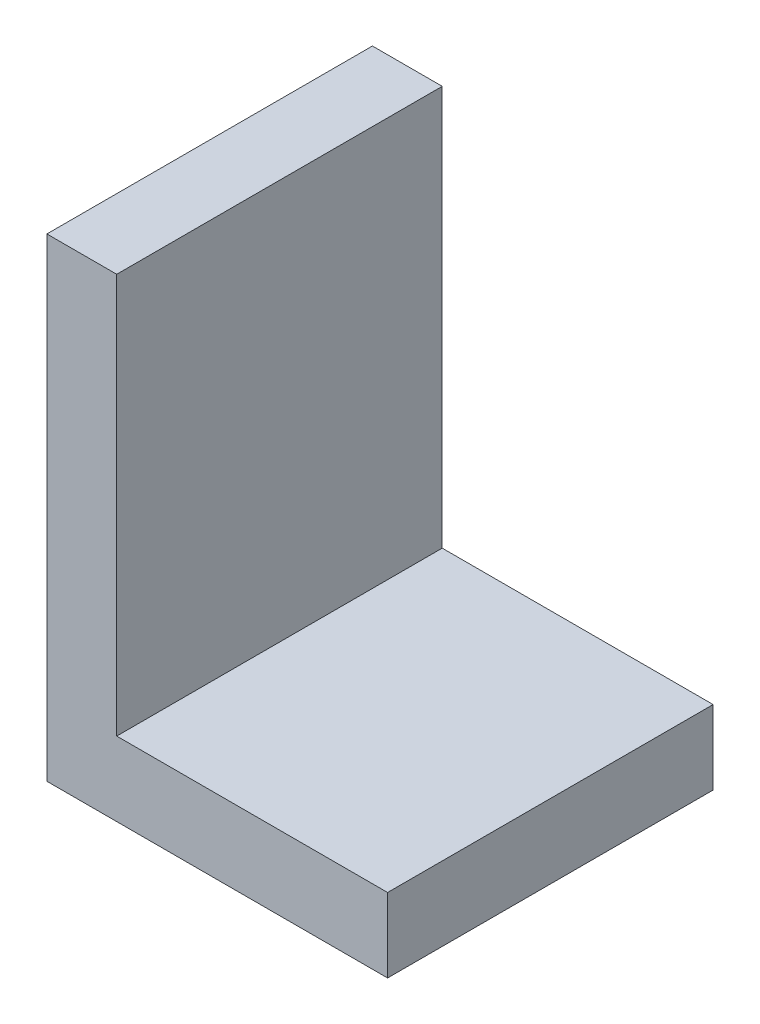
SolidWorks part; units mm, degrees
ref_plane "Front Plane" through (0, 0, 0) normal (0, 0, 1) x (1, 0, 0)
ref_plane "Top Plane" through (0, 0, 0) normal (0, 1, 0) x (1, 0, 0)
ref_plane "Right Plane" through (0, 0, 0) normal (1, 0, 0) x (0, 0, -1)
sketch "Sketch1" plane through (0, 0, 0) normal (0, 0, 1) x (1, 0, 0)
  line L0 (0, 0) -> (0, 95.0585)
  line L1 (0, 95.0585) -> (14.0041, 95.0585)
  line L2 (14.0041, 95.0585) -> (14.0041, 14.8529)
  line L3 (14.0041, 14.8529) -> (68.3233, 14.8529)
  line L4 (68.3233, 14.8529) -> (68.3233, 0)
  line L5 (68.3233, 0) -> (0, 0)
extrude "Extrude1" add sketch "Sketch1" along normal mid plane 65.278
